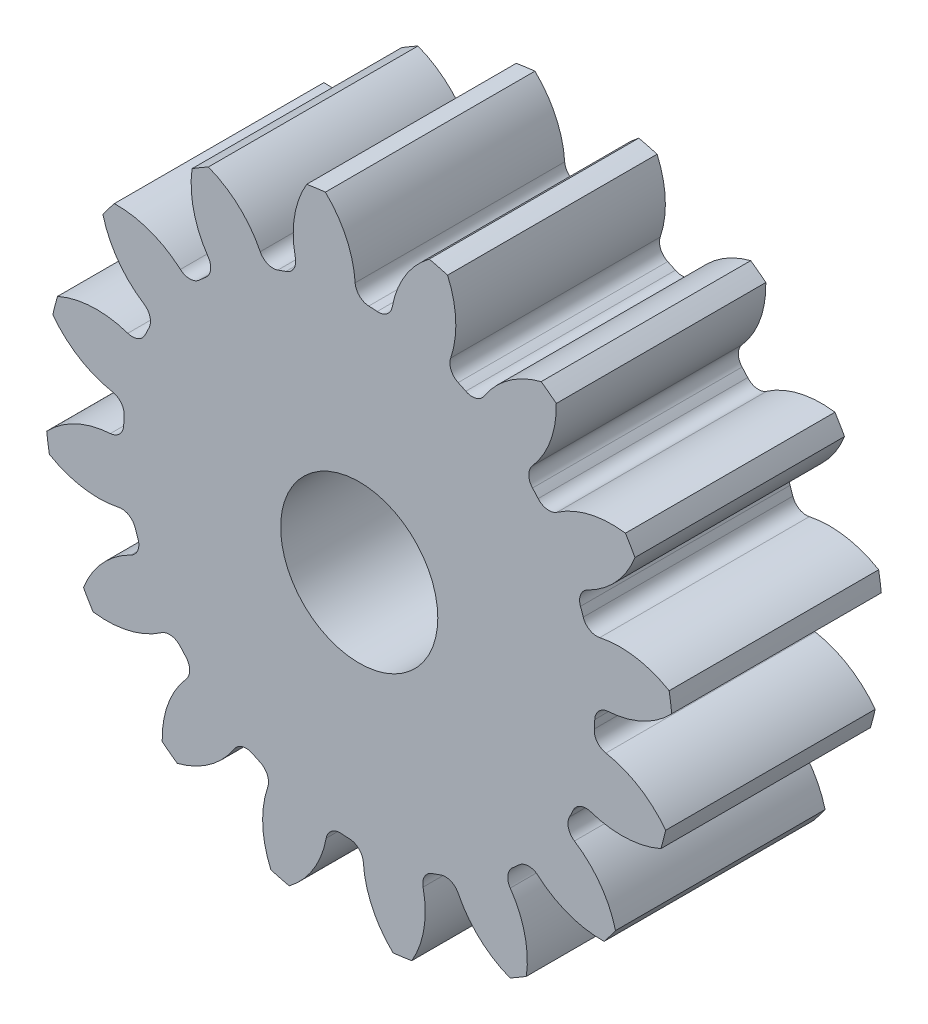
SolidWorks part; units mm, degrees
ref_plane "Front" through (0, 0, 0) normal (0, 0, 1) x (1, 0, 0)
ref_plane "Top" through (0, 0, 0) normal (0, 1, 0) x (1, 0, 0)
ref_plane "Right" through (0, 0, 0) normal (1, 0, 0) x (0, 0, -1)
sketch "Sketch3" plane through (0, 0, 0) normal (0, 0, 1) x (1, 0, 0)
  circle A0 centre (0, 0) radius 152.4
  dimension "od" = 304.8
extrude "gearBody" add sketch "Sketch3" along normal blind 101.6
sketch "Sketch2" plane through (0, 0, 0) normal (0, 0, 1) x (1, 0, 0)
  line L0 (0, 0) -> (117.6071, 48.7145) construction
  line L1 (149.3374, -35.0075) -> (0, 0) construction
  line L2 (0, 0) -> (36.3143, 0) construction
  line L3 (135.36, 5.374) -> (133.8109, -21.1155) construction
  line L5 (134.5855, -7.8708) -> (0, 0) construction
  line L7 (0, 0) -> (127.297, 0) construction
  arc A0 (127.2643, 2.8855) -> (126.0604, -17.7003) centre (0, 0) ccw construction
  arc A1 (151.5144, 16.4057) -> (148.5692, -33.9551) centre (0, 0) ccw construction
  arc A2 (135.36, 5.374) -> (133.8109, -21.1155) centre (0, 0) ccw construction
  arc A3 (113.9667, -8.7229) -> (114.2065, -4.621) centre (0, 0) ccw
  arc A4 (149.3374, -35.0075) -> (119.5927, -16.0272) centre (111.127, -62.0912) ccw
  arc A5 (149.3374, -35.0075) -> (152.4, 17.3614) centre (0, 0) ccw
  arc A6 (152.4, 17.3614) -> (120.6457, 1.9777) centre (117.6071, 48.7145) cw
  arc A7 (114.2065, -4.621) -> (120.6457, 1.9777) centre (121.0928, -4.8997) cw
  arc A8 (119.5927, -16.0272) -> (113.9667, -8.7229) centre (120.8384, -9.2488) cw
  point P6 (152.4, 17.3614)
  point P22 (149.3374, -35.0075)
  dimension "baseDia" = 254.5941
  dimension "od" = 304.8
  dimension "pd" = 270.9333
  dimension "rd" = 228.6
  dimension "rFillet" = 6.8919
  dimension "pointX" = 152.4
  dimension "pointY" = 17.3614
  dimension "CTT" = 26.4896
  dimension "flankCenterAngle" = 22.5
extrude "toothCut" cut sketch "Sketch2" along normal through all
pattern_circular "CirPattern1" count 16 over 360 about axis through (0, 0, 0) along (0, 0, 1) of "toothCut"
sketch "hub1Dia" plane through (0, 0, 0) normal (0, 0, -1) x (-1, 0, 0)
  circle A0 centre (0, 0) radius 12.7
  dimension "hub1Dia" = 25.4
sketch "hub2Dia" plane through (0, 0, 101.6) normal (0, 0, 1) x (1, 0, 0)
  circle A0 centre (0, 0) radius 12.7
  dimension "hub2dia" = 25.4
sketch "boreDia" plane through (0, 0, 0) normal (0, 0, 1) x (1, 0, 0)
  circle A0 centre (0, 0) radius 38.1
  dimension "boreDia" = 76.2
extrude "bore" cut sketch "boreDia" against normal mid plane 25400
